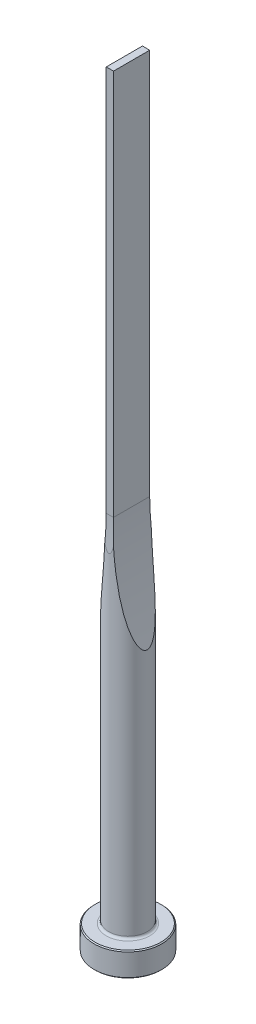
SolidWorks part; units mm, degrees
ref_plane "Front Plane" through (0, 0, 0) normal (0, 0, 1) x (1, 0, 0)
ref_plane "Top Plane" through (0, 0, 0) normal (0, 1, 0) x (1, 0, 0)
ref_plane "Right Plane" through (0, 0, 0) normal (1, 0, 0) x (0, 0, -1)
sketch "Sketch1" plane through (0, 0, 0) normal (0, 0, 1) x (1, 0, 0)
  line L0 (0, 0) -> (6.8, 0)
  line L1 (55, 0) -> (-55, 0) construction
  line L2 (7, 0.2) -> (7, 4.8)
  line L3 (6.8, 5) -> (4.5, 5)
  line L4 (4, 5.5) -> (4, 160)
  line L5 (0, 160) -> (4, 160)
  line L6 (7, 4.8) -> (6.8, 5)
  line L7 (6.8, 0) -> (7, 0.2)
  line L8 (0, 160) -> (0, 0)
  arc A0 (4, 5.5) -> (4.5, 5) centre (4.5, 5.5) ccw
  point P1 (7, 0)
  point P6 (7, 5)
  dimension "D4" = 0.5
  dimension "D1" = 4
  dimension "D2" = 7
  dimension "D3" = 5
  dimension "D5" = 160
revolve "Revolve1" add sketch "Sketch1" angle 360 about L8
sketch "Sketch2" plane through (0, 0, 0) normal (0, 0, 1) x (1, 0, 0)
  line L0 (0.75, 160) -> (0.75, 80)
  line L1 (4, 160) -> (-4, 160) construction
  line L2 (-0.75, 160) -> (-0.75, 80)
  line L3 (4, 160) -> (4, 56.0326)
  line L4 (-4, 160) -> (-4, 56.0326)
  line L5 (0, -7.7) -> (0, 7.7) construction
  line L6 (4, 160) -> (0.75, 160)
  line L8 (-0.75, 160) -> (-4, 160)
  arc A0 (0.75, 80) -> (4, 56.0326) centre (90.75, 80) ccw
  arc A1 (-0.75, 80) -> (-4, 56.0326) centre (-90.75, 80) cw
  dimension "D4" = 90
  dimension "D1" = 80
  dimension "D2" = 1.5
  dimension "D3" = 0.75
extrude "Cut-Extrude1" cut sketch "Sketch2" against normal mid plane 10
sketch "Sketch3" plane through (0, 0, 0) normal (1, 0, 0) x (0, 0, -1)
  line L0 (3.75, 160) -> (3.75, 80)
  line L1 (-3.9291, 160) -> (3.9291, 160) construction
  line L2 (-3.75, 160) -> (-3.75, 80)
  line L3 (4, 160) -> (4, 73.2965)
  line L4 (3.75, 160) -> (4, 160)
  line L5 (0, 7.7) -> (0, -7.7) construction
  line L6 (-4, 160) -> (-4, 73.2965)
  line L8 (-3.75, 160) -> (-4, 160)
  arc A0 (3.75, 80) -> (4, 73.2965) centre (93.75, 80) ccw
  arc A1 (-3.75, 80) -> (-4, 73.2965) centre (-93.75, 80) cw
  dimension "D2" = 90
  dimension "D1" = 80
  dimension "D3" = 7.5
  dimension "D4" = 3.75
extrude "Cut-Extrude2" cut sketch "Sketch3" against normal mid plane 10
